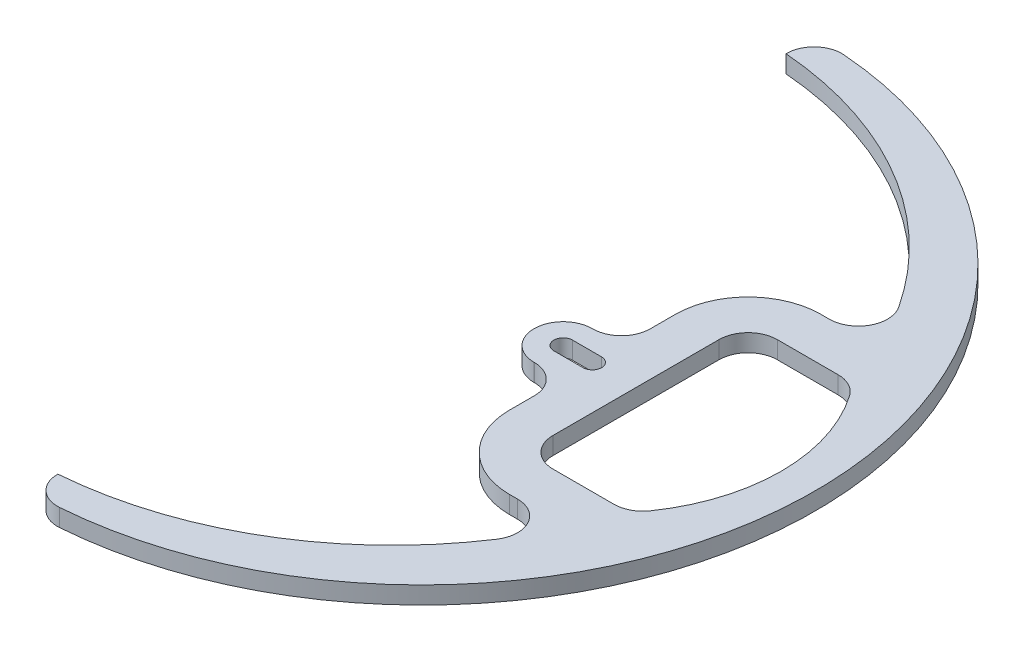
SolidWorks part; units mm, degrees
ref_plane "Plan de face" through (0, 0, 0) normal (0, 0, 1) x (1, 0, 0)
ref_plane "Plan de dessus" through (0, 0, 0) normal (0, 1, 0) x (1, 0, 0)
ref_plane "Plan de droite" through (0, 0, 0) normal (1, 0, 0) x (0, 0, -1)
sketch "Esquisse1" plane through (0, 0, 0) normal (0, 1, 0) x (1, 0, 0)
  line L0 (-177.9243, 0) -> (224.6136, 0) construction
  line L1 (215.3126, 28.5) -> (126.0201, 28.5) construction
  line L2 (126.0201, -28.5) -> (215.3126, -28.5) construction
  line L3 (128.5, 30.4091) -> (128.5, -30.314) construction
  line L4 (-296.5055, -95) -> (73.4193, -95) construction
  line L5 (-296.5055, 95) -> (100.8709, 95) construction
  line L6 (11.4792, -125) -> (212.2239, -125) construction
  line L7 (11.4792, 125) -> (212.2239, 125) construction
  line L8 (50, 171.1415) -> (50, -143.9332) construction
  line L9 (160, 30.4091) -> (160, -25.8067) construction
  line L10 (175, 232.2214) -> (175, -105.6103) construction
  line L11 (19, 137.106) -> (19, 85.2665) construction
  line L12 (-6, -111.6679) -> (-6, 106.486) construction
  line L13 (131.5, 30.4091) -> (131.5, 7.7475) construction
  line L14 (40, 17.6325) -> (40, -7.1029) construction
  line L15 (-26, 153.4637) -> (-26, -152.802) construction
  line L16 (185, 17.6325) -> (185, -143.9332) construction
  line L17 (224.6136, 135) -> (-90, 135) construction
  line L18 (224.6136, -135) -> (-90, -135) construction
  line L19 (127.1704, 25.5) -> (148.3295, 25.5) construction
  line L20 (153, 19.3913) -> (153, -24.3043) construction
  line L21 (150, 28.5) -> (161.7718, 16.7282) construction
  line L22 (150, -28.5) -> (161.7718, -16.7282) construction
  line L23 (115.7723, 38.5) -> (165, 38.5) construction
  line L24 (165, -38.5) -> (120.2184, -38.5) construction
  line L25 (123.5, 43.0556) -> (123.5, -44.6878) construction
  line L26 (84.2183, 53.5) -> (155, 53.5) construction
  line L27 (106.1025, -53.5) -> (155, -53.5) construction
  line L28 (108.5, 65.1057) -> (108.5, -66.9632) construction
  line L29 (98.5, 10) -> (98.6, 10)
  line L30 (108.5, 28.5) -> (108.5, 19.9)
  line L31 (84.2183, 10) -> (115.7723, 10) construction
  line L32 (50, 125.1399) -> (50, 125)
  line L33 (84.2183, -15.8151) -> (113.991, -15.8151) construction
  line L34 (91.5978, 25.5) -> (91.5978, -30.314) construction
  line L35 (50, -125) -> (50, -125.1399)
  line L36 (98.5, 7.7475) -> (98.5, -6.2553) construction
  line L37 (133.5, 53.5) -> (136.3575, 53.5)
  line L38 (154.4062, 38.5) -> (133.5, 38.5)
  line L39 (123.5, 28.5) -> (123.5, -28.5)
  line L40 (133.5, -38.5) -> (154.4062, -38.5)
  line L41 (98.5, -10) -> (98.6, -10)
  line L42 (108.5, -19.9) -> (108.5, -28.5)
  line L43 (133.5, -53.5) -> (136.3575, -53.5)
  line L44 (98.5, 3.2) -> (108.5, 3.2)
  line L45 (98.5, -3.2) -> (108.5, -3.2)
  line L46 (150, 30.4091) -> (150, -31.4522) construction
  arc A0 (50, -125) -> (50, 125) centre (50, 0) ccw construction
  arc A1 (60.2191, -134.6127) -> (60.2191, 134.6127) centre (50, 0) ccw
  arc A2 (50, -95) -> (50, 95) centre (50, 0) ccw construction
  arc A3 (-50, 95) -> (-50, -95) centre (-50, 0) ccw construction
  arc A5 (108.5, -3.2) -> (108.5, 3.2) centre (108.5, 0) ccw
  arc A6 (98.5, 3.2) -> (98.5, -3.2) centre (98.5, 0) ccw
  arc A7 (98.5, 10) -> (98.5, -10) centre (98.5, 0) ccw
  arc A8 (50, -125) -> (144.7074, -69.0026) centre (40, 0) ccw
  arc A9 (144.7074, 69.0026) -> (50, 125) centre (40, 0) ccw
  arc A10 (162.6227, 34.2) -> (162.6227, -34.2) centre (113.324, 0) cw
  arc A11 (50, 125.1399) -> (60.2191, 134.6127) centre (59.5, 125.1399) cw
  arc A12 (50, -125.1399) -> (60.2191, -134.6127) centre (59.5, -125.1399) ccw
  arc A13 (154.4062, -38.5) -> (162.6227, -34.2) centre (154.4062, -28.5) ccw
  arc A14 (154.4062, 38.5) -> (162.6227, 34.2) centre (154.4062, 28.5) cw
  arc A15 (108.5, 28.5) -> (133.5, 53.5) centre (133.5, 28.5) cw
  arc A16 (108.5, -28.5) -> (133.5, -53.5) centre (133.5, -28.5) ccw
  arc A17 (123.5, -28.5) -> (133.5, -38.5) centre (133.5, -28.5) ccw
  arc A18 (133.5, 38.5) -> (123.5, 28.5) centre (133.5, 28.5) ccw
  arc A19 (144.7074, 69.0026) -> (136.3575, 53.5) centre (136.3575, 63.5) cw
  arc A20 (144.7074, -69.0026) -> (136.3575, -53.5) centre (136.3575, -63.5) ccw
  arc A21 (98.6, 10) -> (108.5, 19.9) centre (98.6, 19.9) ccw
  arc A22 (108.5, -19.9) -> (98.6, -10) centre (98.6, -19.9) ccw
  point P96 (159.343, -38.5)
  point P103 (159.343, 38.5)
  point P120 (153.4141, 53.5)
  point P123 (153.4141, -53.5)
  point P125 (108.5, 10)
  point P128 (108.5, -10)
  dimension "D21" = 10
  dimension "D7" = 45
  dimension "D23" = 135
  dimension "D26" = 10
  dimension "D27" = 25
  dimension "D29" = 10
  dimension "D30" = 45
  dimension "D15" = 10
  dimension "D5" = 9.5
  dimension "D13" = 10
  dimension "D20" = 10
  dimension "D28" = 9.9
  dimension "D3" = 28.5
  dimension "D4" = 57
  dimension "D6" = 125
  dimension "D8" = 125
  dimension "D9" = 3
  dimension "D10" = 7
  dimension "D11" = 3
  dimension "D12" = 10
  dimension "D14" = 15
  dimension "D16" = 31.5
  dimension "D17" = 15
  dimension "D18" = 15
  dimension "D19" = 15
  dimension "D22" = 125
  dimension "D24" = 135
  dimension "D25" = 135
extrude "Extrusion1" add sketch "Esquisse1" along normal blind 6
